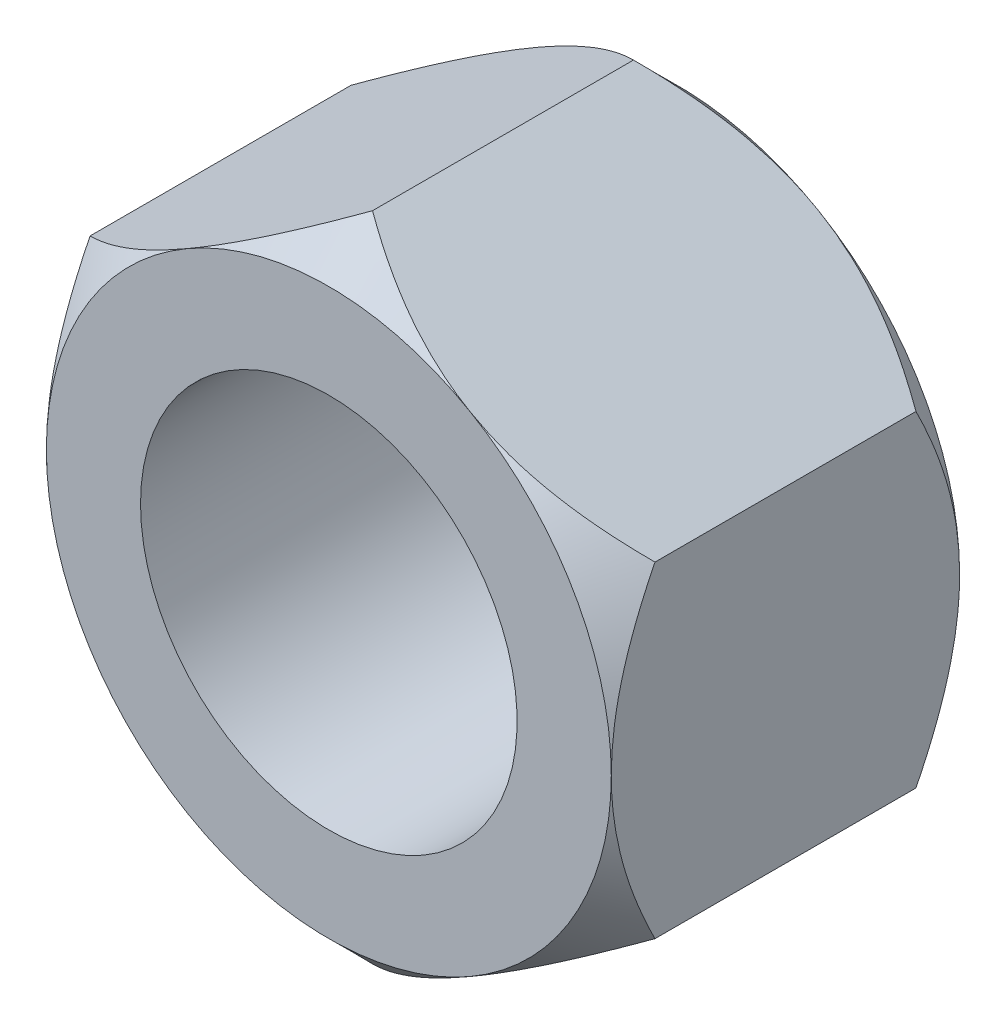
SolidWorks part; units mm, degrees
ref_plane "Plan1" through (0, 0, 0) normal (0, 0, 1) x (1, 0, 0)
ref_plane "Plan2" through (0, 0, 0) normal (0, 1, 0) x (1, 0, 0)
ref_plane "Plan3" through (0, 0, 0) normal (1, 0, 0) x (0, 0, -1)
sketch "E_corps" plane through (0, 0, 0) normal (0, 0, 1) x (1, 0, 0)
  line L0 (0, 91.6337) -> (0, -97.1696) construction
  line L1 (0, 13.8564) -> (12, 6.9282)
  line L2 (0, 13.8564) -> (-12, 6.9282)
  line L3 (12, 6.9282) -> (12, -6.9282)
  line L4 (-12, 6.9282) -> (-12, -6.9282)
  line L5 (12, -6.9282) -> (0, -13.8564)
  line L6 (-12, -6.9282) -> (0, -13.8564)
  circle A0 centre (0, 0) radius 13.8564 construction
  dimension "a" = 24
extrude "Corps" add sketch "E_corps" along normal blind 14.8
sketch "E_chanfrein" plane through (0, 0, 14.8) normal (0, 0, 1) x (1, 0, 0)
  line L0 (12, 6.9282) -> (12, -6.9282) construction
  circle A0 centre (0, 0) radius 12
extrude "Chanfrein" cut sketch "E_chanfrein" against normal through all draft 45 flip side to cut
ref_plane "Plan_de_symétrie" through (0, 0, 7.4) normal (0, 0, 1) x (1, 0, 0)
mirror "Symétrie" about plane through (0, 0, 7.4) normal (0, 0, 1) of "Chanfrein"
sketch "E_perçage" plane through (0, 0, 0) normal (0, 0, -1) x (-1, 0, 0)
  circle A0 centre (0, 0) radius 8
  dimension "Diamètre_nominale" = 16
extrude "Perçage_diamètre_nominal" cut sketch "E_perçage" against normal through all
equation "\"D1@Plan_de_symétrie\" = 0.5*\"Hauteur@Corps\""
